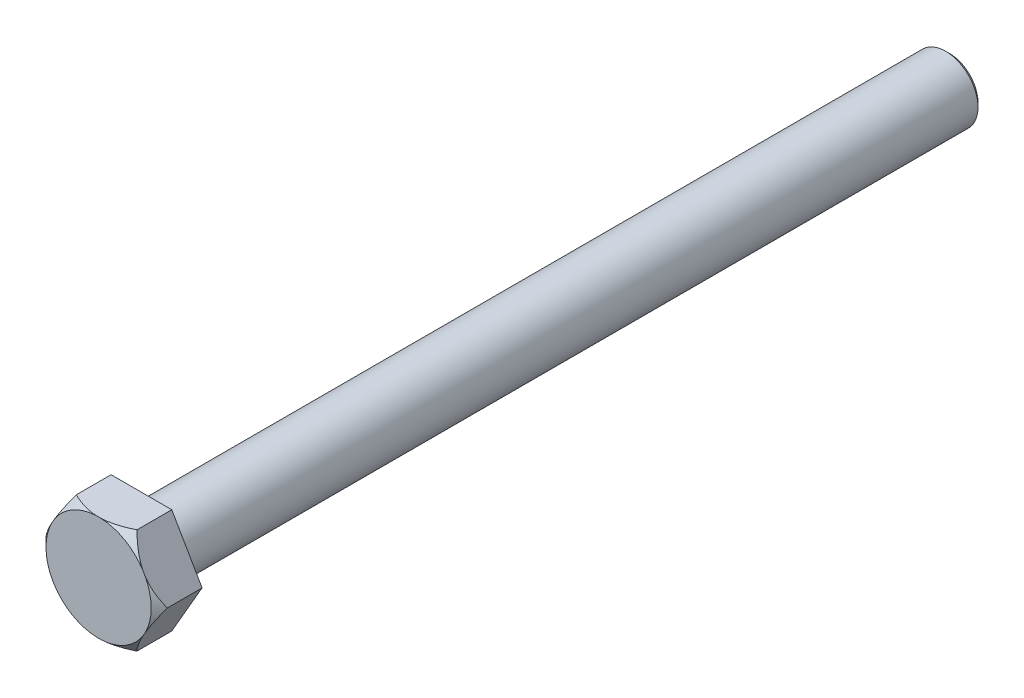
SolidWorks part; units mm, degrees
ref_plane "Plan de face" through (0, 0, 0) normal (0, 0, 1) x (1, 0, 0)
ref_plane "Plan de dessus" through (0, 0, 0) normal (0, 1, 0) x (1, 0, 0)
ref_plane "Plan de droite" through (0, 0, 0) normal (1, 0, 0) x (0, 0, -1)
sketch "Esquisse1" plane through (0, 0, 0) normal (0, 0, 1) x (1, 0, 0)
  line L1 (7.5056, 0) -> (3.7528, 6.5)
  line L2 (3.7528, 6.5) -> (-3.7528, 6.5)
  line L3 (-3.7528, 6.5) -> (-7.5056, 0)
  line L4 (-7.5056, 0) -> (-3.7528, -6.5)
  line L5 (-3.7528, -6.5) -> (3.7528, -6.5)
  line L6 (3.7528, -6.5) -> (7.5056, 0)
  circle A0 centre (0, 0) radius 6.5 construction
  dimension "D1" = 13
extrude "Boss.-Extru.1" add sketch "Esquisse1" along normal blind 5.3
sketch "Esquisse3" plane through (0, 0, 0) normal (0, 1, 0) x (1, 0, 0)
  line L0 (0, 2.9031) -> (0, -10.4428) construction
  line L1 (-7.5056, -4.3) -> (-6.5056, -5.3)
  line L2 (-9.0249, -6.1429) -> (-6.5056, -6.1429)
  line L3 (-9.0249, -6.1429) -> (-9.0249, -4.3)
  line L4 (-9.0249, -4.3) -> (-7.5056, -4.3)
  line L5 (-6.5056, -6.1429) -> (-6.5056, -5.3)
  line L6 (-7.5056, -5.3) -> (-7.5056, 0) construction
  line L8 (-3.7528, -5.3) -> (-7.5056, -5.3) construction
  dimension "D1" = 1
  dimension "D2" = 1
revolve "Enlèvement de matière-Révolution2" cut sketch "Esquisse3" angle 360 about L0
sketch "Esquisse4" plane through (0, 0, 0) normal (1, 0, 0) x (0, 0, -1)
  line L0 (0, 0) -> (83.8832, 0) construction
  line L1 (0, -4) -> (99.5, -4)
  line L2 (0, -6.5) -> (0, 0) construction
  line L3 (100, -3.5) -> (100, 0)
  line L4 (99.5, -4) -> (100, -3.5)
  line L5 (0, -4) -> (0, 0)
  line L6 (0, 0) -> (100, 0)
  point P4 (100, -4)
  dimension "D1" = 4
  dimension "D2" = 100
  dimension "D6" = 0.5
revolve "Révolution2" add sketch "Esquisse4" angle 360 about L0
